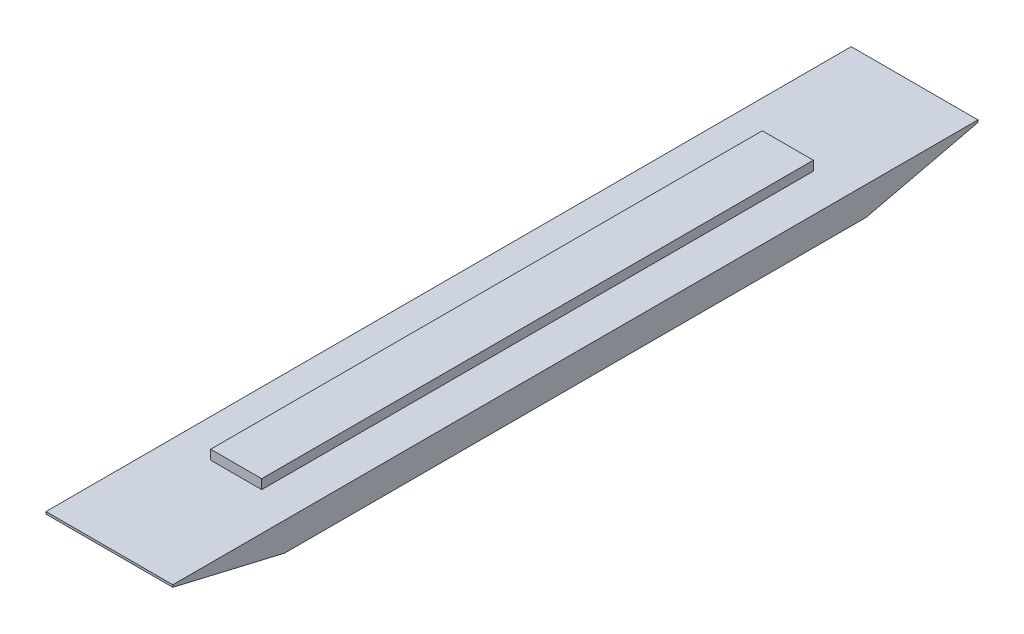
SolidWorks part; units mm, degrees
ref_plane "Face" through (0, 0, 0) normal (0, 0, 1) x (1, 0, 0)
ref_plane "Dessus" through (0, 0, 0) normal (0, 1, 0) x (1, 0, 0)
ref_plane "Droite" through (0, 0, 0) normal (1, 0, 0) x (0, 0, -1)
sketch "Esquisse1" plane through (0, 0, 0) normal (0, 0, 1) x (1, 0, 0)
  line L1 (-200, 45) -> (-80.5, 45)
  line L2 (-200, 45) -> (-200, -45)
  line L3 (-200, -45) -> (200, -45)
  line L4 (200, 45) -> (200, -45)
  line L5 (80.5, 45) -> (200, 45)
  line L6 (-80.5, 75) -> (80.5, 75)
  line L7 (-80.5, 75) -> (-80.5, 45)
  line L9 (80.5, 75) -> (80.5, 45)
  dimension "D1" = 400
  dimension "D2" = 90
  dimension "D3" = 119.5
  dimension "D4" = 119.5
  dimension "D5" = 30
extrude "Extrusion1" add sketch "Esquisse1" along normal mid plane 1740
sketch "Esquisse3" plane through (0, 0, -870) normal (0, 0, -1) x (-1, 0, 0)
  line L1 (200, -45) -> (-200, -45) construction
  line L2 (170, -45) -> (152, -45)
  line L3 (170, -45) -> (170, -10)
  line L4 (152, -10) -> (141, -10)
  line L6 (152, -45) -> (152, -10)
  line L7 (200, 45) -> (200, -45) construction
  line L9 (181, -10) -> (170, -10)
  line L10 (181, -10) -> (181, 5.9886)
  line L11 (181, 5.9886) -> (141, 5.9886)
  line L12 (141, -10) -> (141, 5.9886)
  dimension "D1" = 18
  dimension "D2" = 35
  dimension "D3" = 30
  dimension "D4" = 40
  dimension "D5" = 11
extrude "Enlèv. mat.-Extru.5" cut sketch "Esquisse3" against normal through all
pattern_linear "Répétition linéaire1" count 5 spacing 80
sketch "Esquisse4" plane through (0, 0, 870) normal (0, 0, 1) x (1, 0, 0)
  line L1 (-200, 45) -> (200, 45)
  line L2 (-200, 45) -> (-200, -45)
  line L3 (-200, -45) -> (200, -45)
  line L4 (200, 45) -> (200, -45)
extrude "Extrusion3" add sketch "Esquisse4" along normal blind 400
sketch "Esquisse5" plane through (-200, 0, 0) normal (-1, 0, 0) x (0, 0, 1)
  line L0 (783.804, -76.4638) -> (1412.3916, 71.4392)
extrude "Enlèv. mat.-Extru.7" cut sketch "Esquisse5" against normal through all and the other way through all flip side to cut
sketch "Esquisse6" plane through (0, 0, 1270) normal (0, 0, 1) x (1, 0, 0)
  line L1 (200, -45) -> (-200, -45) construction
  line L2 (192, -45) -> (-192, -45)
  line L3 (192, -45) -> (192, 37.9353)
  line L4 (192, 37.9353) -> (-192, 37.9353)
  line L10 (-192, -45) -> (-192, 37.9353)
  line L11 (200, 37.9353) -> (-200, 37.9353) construction
  line L12 (200, 37.9353) -> (200, -45) construction
  line L13 (-200, 45) -> (-200, -45) construction
  line L14 (-200, -45) -> (-200, 37.9353) construction
  dimension "D1" = 8
  dimension "D2" = 8
extrude "Enlèv. mat.-Extru.8" cut sketch "Esquisse6" against normal blind 330
sketch "Esquisse7" plane through (-152, 0, 0) normal (-1, 0, 0) x (0, 0, 1)
  line L2 (870, 5.9886) -> (-870, 5.9886) construction
  line L3 (870, -45) -> (820, -45)
  line L4 (870, -45) -> (870, 5.9886)
  line L5 (870, 5.9886) -> (820, 5.9886)
  line L6 (820, -45) -> (820, 5.9886)
  dimension "D1" = 50
extrude "Enlèv. mat.-Extru.9" cut sketch "Esquisse7" against normal up to surface (320 mm away)
ref_plane "Plan1" through (0, 0, 0) normal (0, 0, 1) x (1, 0, 0)
mirror "Symétrie2" about plane through (0, 0, 0) normal (0, 0, 1)
